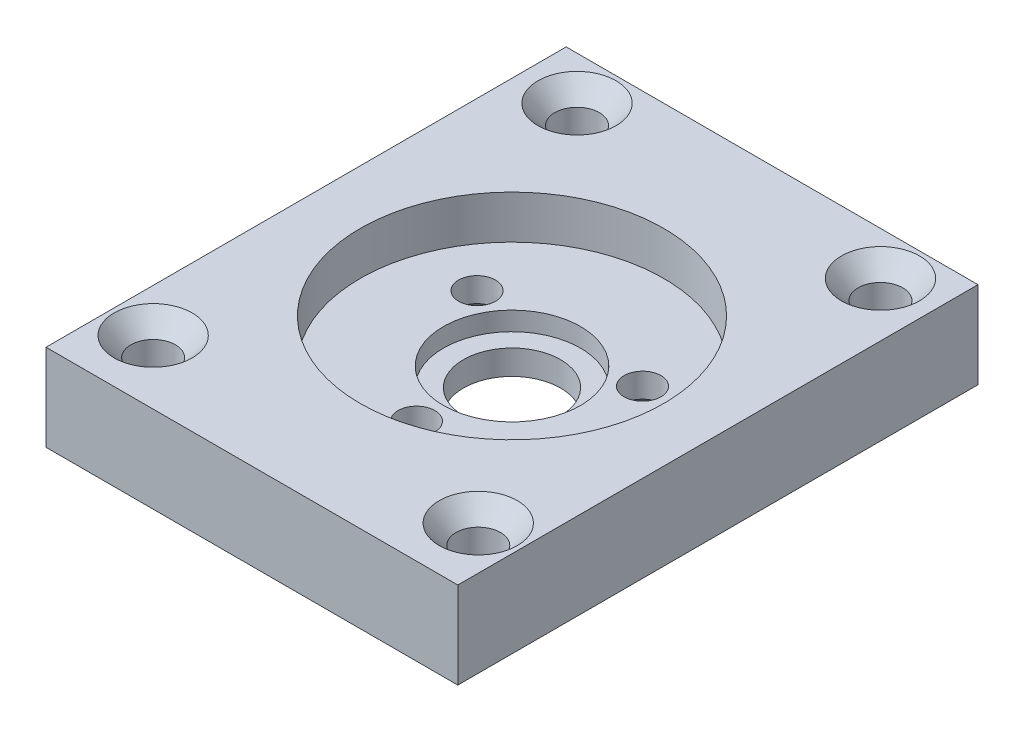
SolidWorks part; units mm, degrees
ref_plane "Front Plane" through (0, 0, 0) normal (0, 0, 1) x (1, 0, 0)
ref_plane "Top Plane" through (0, 0, 0) normal (0, 1, 0) x (1, 0, 0)
ref_plane "Right Plane" through (0, 0, 0) normal (1, 0, 0) x (0, 0, -1)
sketch "Sketch1" plane through (0, 0, 0) normal (1, 0, 0) x (0, 0, -1)
  line L0 (-19.05, 0) -> (0, 0) construction
  line L1 (-19.05, 3.175) -> (19.05, 3.175)
  line L2 (-19.05, 3.175) -> (-19.05, -3.175)
  line L3 (-19.05, -3.175) -> (19.05, -3.175)
  line L4 (19.05, 3.175) -> (19.05, -3.175)
  dimension "D1" = 6.35
  dimension "D2" = 38.1
  dimension "D3" = 19.05
extrude "Extrude1" add sketch "Sketch1" along normal mid plane 30.1625
sketch "Sketch2" plane through (0, 3.175, 0) normal (0, 1, 0) x (1, 0, 0)
  circle A0 centre (0, 0) radius 11.1125
  dimension "D2" = 22.225
extrude "Cut-Extrude1" cut sketch "Sketch2" against normal blind 3.175
sketch "Sketch3" plane through (0, 0, 0) normal (0, 1, 0) x (1, 0, 0)
  circle A0 centre (0, 0) radius 5.0165
  dimension "D1" = 10.033
extrude "Cut-Extrude2" cut sketch "Sketch3" against normal blind 1.3716
sketch "Sketch4" plane through (0, -1.3716, 0) normal (0, 1, 0) x (1, 0, 0)
  circle A0 centre (0, 0) radius 3.556
  dimension "D1" = 7.112
extrude "Cut-Extrude3" cut sketch "Sketch4" against normal up to next
sketch "Sketch5" plane through (0, -3.175, 0) normal (0, -1, 0) x (1, 0, 0)
  circle A0 centre (0, 6.9977) radius 1.016
  circle A2 centre (6.0602, -3.4989) radius 1.016
  circle A3 centre (-6.0602, -3.4989) radius 1.016
  circle A4 centre (0, 0) radius 6.9977 construction
  dimension "D1" = 2.032
  dimension "D3" = 13.9954
  dimension "D4" = 3
extrude "Cut-Extrude4" cut sketch "Sketch5" against normal up to next
hole_wizard "CSK for M2.5 Flat Head Machine Screw1" positions "3DSketch1" profile "Sketch6" countersink size "M2.5" standard "Ansi Metric"
sketch3d "3DSketch1"
  line L0 (6.0602, 0, -3.4989) -> (6.0602, -3.175, -3.4989) construction
  line L1 (-6.0602, 0, -3.4989) -> (-6.0602, -3.175, -3.4989) construction
  line L2 (0, 0, 6.9977) -> (0, -3.175, 6.9977) construction
  point P0 (6.0602, -3.175, -3.4989)
  point P2 (-6.0602, -3.175, -3.4989)
  point P4 (0, -3.175, 6.9977)
sketch "Sketch6" plane through (6.0602, -3.175, -3.4989) normal (1, 0, 0) x (0, 0, -1)
  line L0 (0, 0) -> (0, 6.35)
  line L1 (0, 6.35) -> (1.35, 6.35)
  line L2 (1.35, 6.35) -> (1.35, 1.4)
  line L3 (1.35, 1.4) -> (2.75, 0)
  line L5 (2.75, 0) -> (0, 0)
  line L6 (-1.35, 1.4) -> (-2.75, 0) construction
  line L11 (0, -6.35) -> (0, 107.95) construction
  dimension "Thru Hole Dia." = 2.7
  dimension "Thru Hole Depth" = 6.35
  dimension "Near C'Sink Dia." = 5.5
  dimension "Near C'Sink Angle" = 90
sketch "Sketch12" plane through (0, 3.175, 0) normal (0, 1, 0) x (1, 0, 0)
  circle A0 centre (0, 0) radius 4.7625
  dimension "D1" = 9.525
extrude "Cut-Extrude6" [suppressed] cut sketch "Sketch12" against normal up to next
hole_wizard "CSK for #4 Flat Head Machine Screw2" positions "Sketch21" profile "Sketch20" countersink size "#4" standard "ANSI Inch"
sketch "Sketch21" plane through (0, 3.175, 0) normal (0, 1, 0) x (1, 0, 0)
  line L0 (15.0812, -19.05) -> (-15.0812, -19.05) construction
  point P0 (11.9063, -14.3764)
  point P4 (-11.9062, -14.3764)
  dimension "D1" = 4.6736
  dimension "D2" = 11.9062
  dimension "D3" = 11.9062
sketch "Sketch20" plane through (11.9063, 3.175, 14.3764) normal (1, 0, 0) x (0, 0, 1)
  line L0 (0, 0) -> (0, 6.35)
  line L1 (0, 6.35) -> (1.6319, 6.35)
  line L2 (1.6319, 6.35) -> (1.6319, 1.4098)
  line L3 (1.6319, 1.4098) -> (2.8575, 0)
  line L5 (2.8575, 0) -> (0, 0)
  line L6 (-1.6319, 1.4098) -> (-2.8575, 0) construction
  line L11 (0, -6.35) -> (0, 107.95) construction
  dimension "Thru Hole Dia." = 3.2639
  dimension "Thru Hole Depth" = 6.35
  dimension "Near C'Sink Dia." = 5.715
  dimension "Near C'Sink Angle" = 82
hole_wizard "CSK for #4 Flat Head Machine Screw1" positions "Sketch19" profile "Sketch18" countersink size "#4" standard "ANSI Inch"
sketch "Sketch19" plane through (0, 3.175, 0) normal (0, 1, 0) x (-1, 0, 0)
  line L0 (-15.0812, -19.05) -> (-15.0812, 19.05) construction
  line L1 (-15.0812, -19.05) -> (15.0812, -19.05) construction
  point P0 (-11.1125, -15.875)
  point P1 (11.1125, -15.875)
  dimension "D1" = 11.1125
  dimension "D2" = 11.1125
  dimension "D3" = 3.9688
  dimension "D4" = 15.875
  dimension "D5" = 3.175
sketch "Sketch18" plane through (11.1125, 3.175, -15.875) normal (1, 0, 0) x (0, 0, 1)
  line L0 (0, 0) -> (0, 6.35)
  line L1 (0, 6.35) -> (1.6319, 6.35)
  line L2 (1.6319, 6.35) -> (1.6319, 1.4098)
  line L3 (1.6319, 1.4098) -> (2.8575, 0)
  line L5 (2.8575, 0) -> (0, 0)
  line L6 (-1.6319, 1.4098) -> (-2.8575, 0) construction
  line L11 (0, -6.35) -> (0, 107.95) construction
  dimension "Thru Hole Dia." = 3.2639
  dimension "Thru Hole Depth" = 6.35
  dimension "Near C'Sink Dia." = 5.715
  dimension "Near C'Sink Angle" = 82
